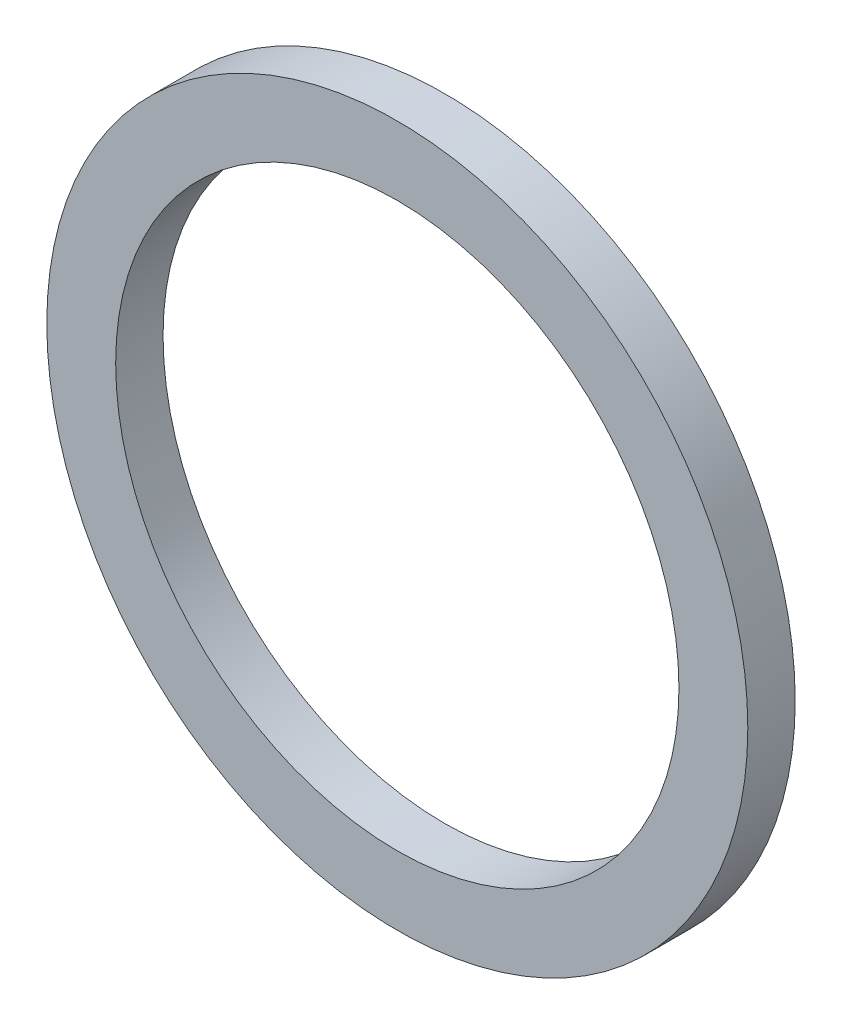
SolidWorks part; units mm, degrees
ref_plane "Front" through (0, 0, 0) normal (0, 0, 1) x (1, 0, 0)
ref_plane "Top" through (0, 0, 0) normal (0, 1, 0) x (1, 0, 0)
ref_plane "Right" through (0, 0, 0) normal (1, 0, 0) x (0, 0, -1)
sketch "Sketch1" plane through (0, 0, 0) normal (0, 0, 1) x (1, 0, 0)
  circle A0 centre (0, 0) radius 8.915
  circle A1 centre (0, 0) radius 11.095
  dimension "D1" = 17.83
  dimension "D2" = 2.18
extrude "Base-Extrude" add sketch "Sketch1" along normal blind 1.5
